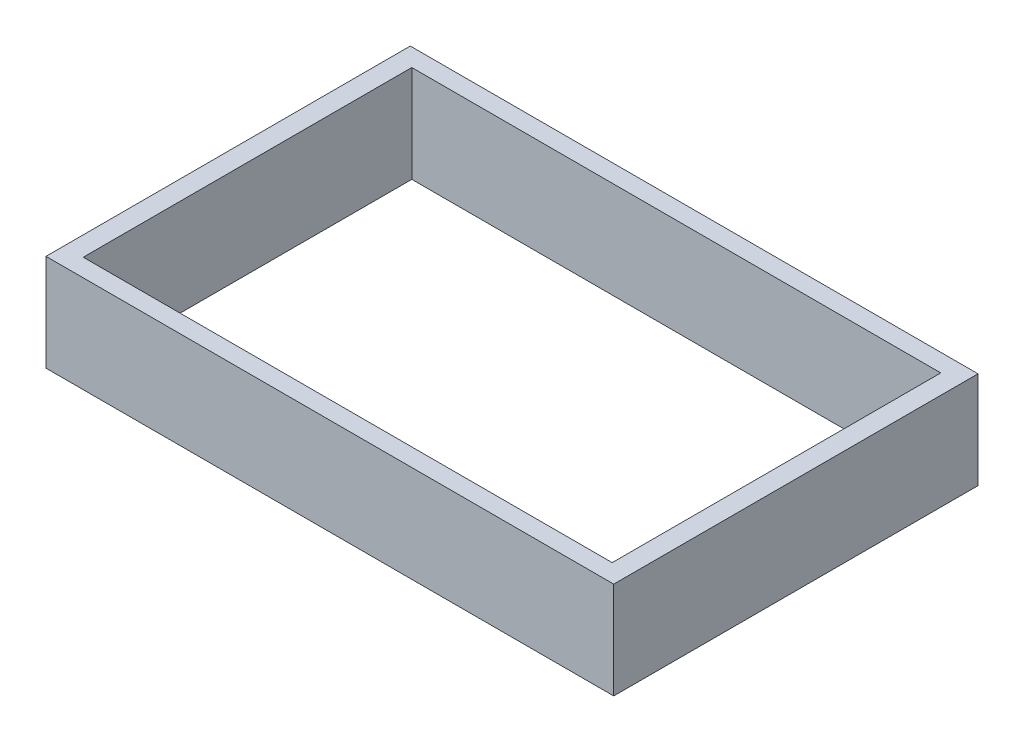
SolidWorks part; units mm, degrees
ref_plane "Front Plane" through (0, 0, 0) normal (0, 0, 1) x (1, 0, 0)
ref_plane "Top Plane" through (0, 0, 0) normal (0, 1, 0) x (1, 0, 0)
ref_plane "Right Plane" through (0, 0, 0) normal (1, 0, 0) x (0, 0, -1)
sketch "Sketch1" plane through (0, 0, 0) normal (0, 1, 0) x (1, 0, 0)
  line L1 (-273, -169.575) -> (273, -169.575)
  line L2 (-273, -169.575) -> (-273, 169.575)
  line L3 (-273, 169.575) -> (273, 169.575)
  line L4 (273, -169.575) -> (273, 169.575)
  line L5 (-273, -169.575) -> (273, 169.575) construction
  line L6 (-273, 169.575) -> (273, -169.575) construction
  line L7 (-293, -188) -> (293, -188)
  line L8 (-293, -188) -> (-293, 188)
  line L9 (-293, 188) -> (293, 188)
  line L10 (293, -188) -> (293, 188)
  line L11 (-293, -188) -> (293, 188) construction
  line L12 (-293, 188) -> (293, -188) construction
  point P0 (0, 0)
  point P6 (0, 0)
  dimension "D1" = 546
  dimension "D2" = 339.15
  dimension "D3" = 586
  dimension "D4" = 376
extrude "Boss-Extrude1" add sketch "Sketch1" along normal blind 100
